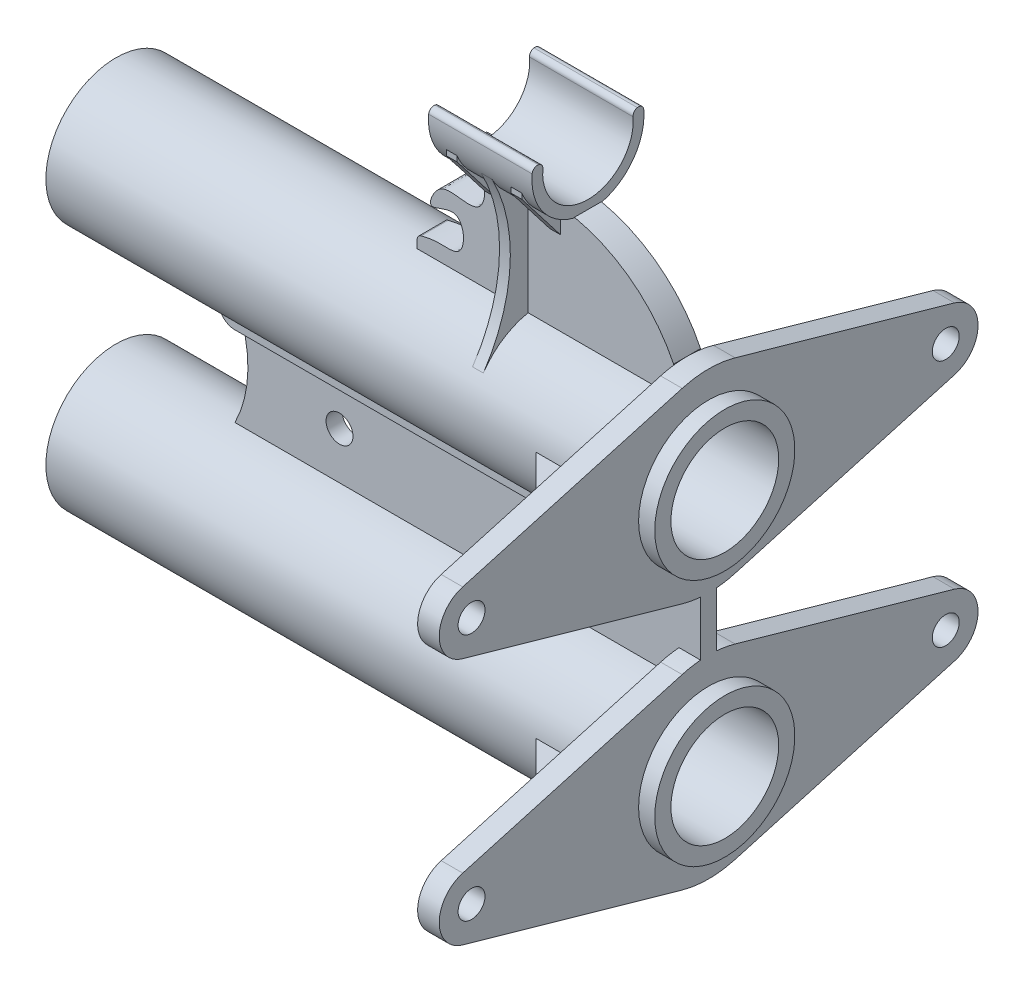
SolidWorks part; units mm, degrees
ref_plane "Front" through (0, 0, 0) normal (0, 0, 1) x (1, 0, 0)
ref_plane "Top" through (0, 0, 0) normal (0, 1, 0) x (1, 0, 0)
ref_plane "Right" through (0, 0, 0) normal (1, 0, 0) x (0, 0, -1)
sketch "Sketch1" plane through (0, 0, 0) normal (1, 0, 0) x (0, 0, -1)
  circle A0 centre (0, 0) radius 8.255
  dimension "D1" = 16.51
extrude "Base-Extrude" add sketch "Sketch1" against normal blind 69.85
sketch "Sketch2" plane through (0, 0, 0) normal (1, 0, 0) x (0, 0, -1)
  line L0 (27.94, 0) -> (-27.94, 0) construction
  line L1 (-28.9791, 3.6656) -> (-3.1173, 10.9967)
  line L2 (3.1173, 10.9967) -> (28.9791, 3.6656)
  line L3 (28.9791, -3.6656) -> (3.1173, -10.9967)
  line L4 (-28.9791, -3.6656) -> (-3.1173, -10.9967)
  arc A0 (-28.9791, 3.6656) -> (-28.9791, -3.6656) centre (-27.94, 0) ccw
  circle A1 centre (0, 0) radius 11.43
  arc A2 (-3.1173, -10.9967) -> (3.1173, -10.9967) centre (0, 0) ccw
  arc A3 (28.9791, -3.6656) -> (28.9791, 3.6656) centre (27.94, 0) ccw
  arc A4 (3.1173, 10.9967) -> (-3.1173, 10.9967) centre (0, 0) ccw
  circle A5 centre (-27.94, 0) radius 1.5875
  circle A6 centre (27.94, 0) radius 1.5875
  dimension "D2" = 7.62
  dimension "D4" = 3.175
  dimension "D3" = 63.5
  dimension "D1" = 3.175
extrude "Boss-Extrude1" add sketch "Sketch2" against normal blind 2.54
sketch "Sketch3" plane through (-69.85, 0, 0) normal (-1, 0, 0) x (0, 0, 1)
  circle A1 centre (0, 0) radius 6.35
  circle A2 centre (0, 0) radius 6.35
  dimension "D1" = 1.905
extrude "Cut-Extrude1" cut sketch "Sketch3" against normal through all
sketch "Sketch4" plane through (0, 0, 0) normal (1, 0, 0) x (0, 0, -1)
  circle A0 centre (0, 0) radius 6.35 construction
  circle A1 centre (0, 0) radius 8.255
  circle A2 centre (0, 0) radius 8.255
  circle A3 centre (0, 0) radius 6.35
  dimension "D1" = 1.905
extrude "Boss-Extrude2" add sketch "Sketch4" along normal blind 1.905
sketch "Sketch6" plane through (0, 0, 0) normal (0, 1, 0) x (1, 0, 0)
  line L0 (-2.54, 7.3025) -> (-13.0175, 7.3025)
  line L1 (-2.54, 7.3025) -> (-2.54, 17.78)
  line L2 (-2.54, 8.255) -> (-69.85, 8.255) construction
  line L4 (-2.54, 3.1173) -> (-2.54, 28.9791) construction
  line L5 (-13.0175, 7.3025) -> (-2.54, 17.78)
  point P7 (-12.065, 8.255)
  dimension "D1" = 0.9525
  dimension "D2" = 9.525
  dimension "D3" = 9.525
extrude "Boss-Extrude4" add sketch "Sketch6" along normal mid plane 1.905
mirror "Mirror1" about plane through (0, 0, 0) normal (0, 0, 1) of "Boss-Extrude4"
sketch "Sketch5" plane through (0, 0, 0) normal (0, 0, 1) x (1, 0, 0)
  line L0 (0, 7.3025) -> (-55.372, 7.3025)
  line L1 (0, 7.3025) -> (0, 21.9075)
  line L2 (-55.372, 21.9075) -> (0, 21.9075)
  line L3 (-2.54, 8.255) -> (-69.85, 8.255) construction
  line L4 (0, 3.6656) -> (0, 10.9967) construction
  line L5 (-2.54, 8.255) -> (-69.85, 8.255) construction
  line L6 (-63.3105, 20.955) -> (7.5357, 20.955) construction
  arc A0 (-55.372, 7.3025) -> (-55.372, 21.9075) centre (-67.4777, 14.605) ccw
  circle A1 centre (-42.545, 13.7414) radius 1.5875
  circle A2 centre (-12.7, 13.7414) radius 1.5875
  dimension "D6" = 3.175
  dimension "D1" = 0.9525
  dimension "D2" = 53.34
  dimension "D3" = 55.372
  dimension "D4" = 0.9525
  dimension "D5" = 12.7
  dimension "D7" = 12.7
  dimension "D8" = 29.845
  dimension "D9" = 5.4864
extrude "Boss-Extrude3" add sketch "Sketch5" along normal mid plane 1.905
pattern_linear "LPattern1" count 2 spacing 29.21 along (0, 1, 0) of "Boss-Extrude2", "Cut-Extrude1", "Boss-Extrude1", "Base-Extrude", "Boss-Extrude4", "Mirror1"
sketch "Sketch7" plane through (0, 0, 0) normal (0, 0, 1) x (1, 0, 0)
  line L0 (-27.94, 50.165) -> (-17.78, 50.165)
  line L1 (-2.54, 37.465) -> (-69.85, 37.465) construction
  line L2 (-2.54, 32.8756) -> (-2.54, 40.2067) construction
  line L3 (-2.54, 36.5125) -> (-2.54, 40.64)
  line L4 (-32.766, 36.5125) -> (-32.766, 38.735)
  line L5 (0, 40.64) -> (-2.54, 40.64) construction
  line L6 (-2.54, 36.5125) -> (-69.85, 36.5125)
  line L7 (-2.54, 36.5125) -> (-32.766, 36.5125)
  line L9 (-32.766, 38.735) -> (-26.6893, 38.735) construction
  line L10 (-26.6893, 38.735) -> (-26.6893, 41.4056) construction
  line L11 (-26.6893, 41.4056) -> (-31.6384, 41.4056) construction
  line L12 (-30.8107, 43.366) -> (-24.734, 43.366) construction
  line L13 (-24.734, 43.366) -> (-24.734, 46.0366) construction
  line L14 (-24.734, 46.0366) -> (-29.6831, 46.0366) construction
  line L15 (-29.6831, 46.0366) -> (-27.94, 50.165) construction
  line L16 (-30.8107, 43.366) -> (-31.6384, 41.4056) construction
  arc A0 (-2.54, 40.64) -> (-17.78, 50.165) centre (-17.78, 33.2105) ccw
  point P21 (-40.9571, 58.7832)
  point P22 (-30.2595, 39.1729)
  point P23 (-27.8077, 44.98)
  point P24 (-28.3103, 49.2879)
  point P25 (-41.2611, 58.6616)
  point P26 (-27.7531, 39.6107)
  point P27 (-28.3605, 43.088)
  point P28 (-31.1325, 42.6037)
  point P29 (-30.3141, 44.5421)
  point P30 (0, 0)
  point P31 (-25.3012, 45.4178)
  point P32 (-25.9087, 48.8951)
  point P33 (-28.6806, 48.4108)
  dimension "D1" = 12.7
  dimension "D2" = 15.24
  dimension "D3" = 25.4
  dimension "D5" = 30.226
  dimension "D6" = 1.27
  dimension "D4" = 0.9525
extrude "Boss-Extrude5" add sketch "Sketch7" along normal mid plane 3.175
fillet "Fillet2" radius 0.635 4 edges at (-27.94, 50.165, 0) (-32.766, 38.735, 0)
ref_plane "Plane4" through (-20.32, 0, 0) normal (1, 0, 0) x (0, 0, -1)
sketch "Sketch8" plane through (-20.32, 0, 0) normal (1, 0, 0) x (0, 0, -1)
  line L0 (-10.4652, 57.404) -> (5.9346, 57.404) construction
  line L1 (-1.5875, 50.165) -> (1.5875, 50.165) construction
  arc A0 (-6.4807, 57.404) -> (6.4807, 57.404) centre (0, 56.134) ccw
  dimension "D1" = 13.208
  dimension "D2" = 1.27
  dimension "D3" = 0.635
extrude "Boss-Extrude-Thin1" add sketch "Sketch8" along normal mid plane 12.192 thin
fillet "Fillet3" radius 0.635 8 edges at (-26.416, 57.2819, 5.8576) (-20.32, 57.1598, 5.2344) (-20.32, 57.404, 6.4807) (-14.224, 57.2819, -5.8576) (-20.32, 57.404, -6.4807) (-20.32, 57.1598, -5.2344) (-14.224, 57.2819, 5.8576) (-26.416, 57.2819, -5.8576)
sketch "Sketch9" plane through (-20.32, 0, 0) normal (1, 0, 0) x (0, 0, -1)
  line L1 (0, 50) -> (0, -50) construction
  line L2 (1.5875, 38.8605) -> (1.5875, 49.771) construction
  line L3 (1.5875, 37.3109) -> (1.5875, 49.7236)
  arc A0 (6.8644, 33.7953) -> (1.5875, 37.3109) centre (0, 29.21) ccw
  arc A1 (5.8472, 53.0644) -> (6.8644, 33.7953) centre (22.5693, 44.2857) ccw
  arc A2 (1.5875, 49.7236) -> (6.5791, 56.7074) centre (0, 56.134) ccw construction
  circle A3 centre (0, 29.21) radius 8.255 construction
  arc A4 (1.5875, 49.7236) -> (5.8472, 53.0644) centre (0, 56.134) ccw
  dimension "D1" = 3.683
extrude "Boss-Extrude6" add sketch "Sketch9" against normal mid plane 1.27
ref_plane "Plane5" through (-23.495, 0, 0) normal (-1, 0, 0) x (0, 0, 1)
sketch "Sketch10" plane through (-23.495, 0, 0) normal (-1, 0, 0) x (0, 0, 1)
  line L0 (-1.5875, 47.1836) -> (-6.1428, 53.0745)
  line L1 (-1.5875, 38.8605) -> (-1.5875, 49.771) construction
  line L2 (-6.1428, 53.0745) -> (-6.1428, 53.7095)
  line L3 (-1.5875, 37.3109) -> (-1.5875, 49.7236) construction
  line L4 (-1.5875, 47.1836) -> (-1.5875, 49.7236)
  arc A0 (-6.1428, 53.7095) -> (-1.5875, 49.7236) centre (0, 56.134) ccw
  arc A1 (-6.5791, 56.7074) -> (-1.5875, 49.7236) centre (0, 56.134) ccw construction
  arc A2 (-6.7056, 56.7184) -> (-1.618, 49.6004) centre (0, 56.134) ccw
  arc A3 (-6.7056, 56.7184) -> (-0.1118, 49.4039) centre (0, 56.134) ccw construction
  dimension "D1" = 2.54
  dimension "D3" = 0.635
  dimension "D2" = 0.127
extrude "Boss-Extrude7" add sketch "Sketch10" along normal blind 1.27
mirror "Mirror2" about plane through (-20.32, 0, 0) normal (1, 0, 0) of "Boss-Extrude7"
sketch "Sketch11" plane through (-2.54, 0, 0) normal (-1, 0, 0) x (0, 0, 1)
  line L0 (-0.9525, 17.8198) -> (-0.9525, 21.0101) construction
  line L1 (-0.9525, 19.5603) -> (-0.9525, 21.0101)
  line L4 (-2.8575, 19.5603) -> (-0.9525, 19.5603)
  line L5 (-2.8575, 19.5603) -> (-2.8575, 21.4653)
  arc A0 (-8.1999, 28.2575) -> (-0.9525, 21.0101) centre (0, 29.21) ccw construction
  arc A1 (-2.8575, 21.4653) -> (-0.9525, 21.0101) centre (0, 29.21) ccw
  dimension "D1" = 1.905
  dimension "D2" = 1.905
extrude "Boss-Extrude8" add sketch "Sketch11" along normal up to surface (51.6969 mm away)
fillet "Fillet4" radius 1.905 1 edges at (-28.3884, 19.5603, -2.8575)
mirror "Mirror3" about plane through (0, 0, 0) normal (0, 0, 1) of "Fillet4", "Boss-Extrude8", "Boss-Extrude6", "Boss-Extrude7", "Mirror2"
sketch "Sketch12" plane through (-69.85, 0, 0) normal (-1, 0, 0) x (0, 0, 1)
  point P0 (0, 29.21)
ref_plane "Plane6" through (0, 29.21, 0) normal (0, 1, 0) x (-1, 0, 0)
